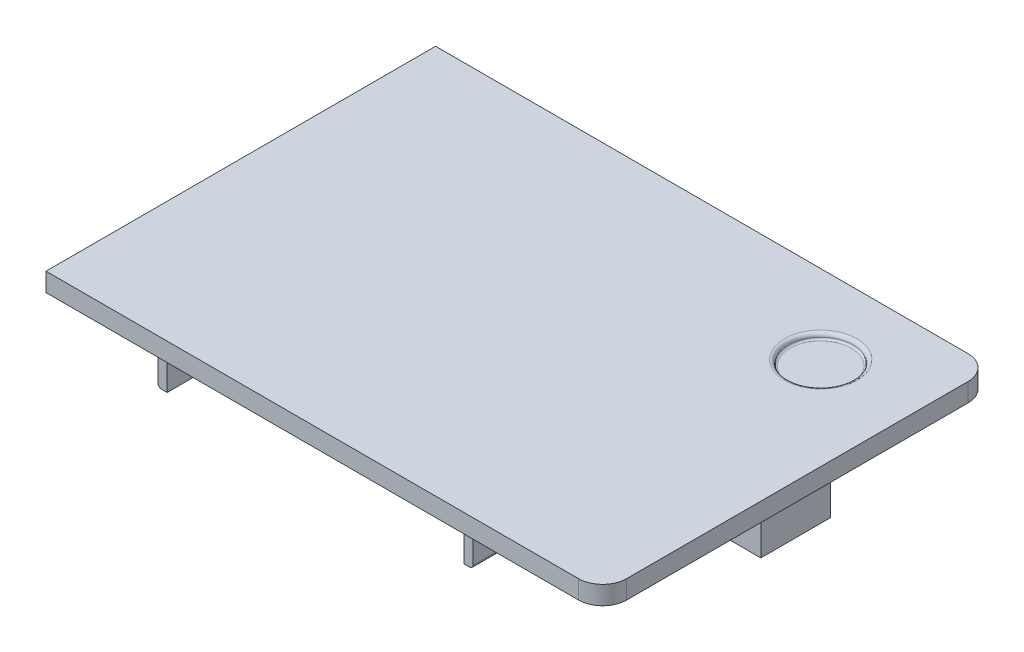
SolidWorks part; units mm, degrees
ref_plane "Front Plane" through (0, 0, 0) normal (0, 0, 1) x (1, 0, 0)
ref_plane "Top Plane" through (0, 0, 0) normal (0, 1, 0) x (1, 0, 0)
ref_plane "Right Plane" through (0, 0, 0) normal (1, 0, 0) x (0, 0, -1)
sketch "Sketch1" plane through (0, 0, 0) normal (0, 1, 0) x (1, 0, 0)
  line L1 (-381, -266.7) -> (381, -266.7)
  line L2 (-381, -266.7) -> (-381, 266.7)
  line L3 (-381, 266.7) -> (381, 266.7)
  line L4 (381, -266.7) -> (381, 266.7)
  line L5 (-381, -266.7) -> (381, 266.7) construction
  line L6 (-381, 266.7) -> (381, -266.7) construction
  point P0 (0, 0)
  dimension "D1" = 762
  dimension "D2" = 533.4
extrude "Boss-Extrude1" add sketch "Sketch1" along normal blind 25.4
fillet "Fillet1" radius 33.02 2 edges at (381, 12.7, -266.7) (381, 12.7, 266.7)
sketch "Sketch2" plane through (0, 0, 0) normal (0, -1, 0) x (1, 0, 0)
  line L0 (-217.7072, 266.7) -> (-217.7072, 114.3)
  line L1 (-381, 266.7) -> (347.98, 266.7) construction
  line L2 (-217.7072, 114.3) -> (188.6928, 114.3)
  line L3 (188.6928, 114.3) -> (188.6928, 266.7)
  line L4 (-230.4072, 266.7) -> (-230.4072, 101.6)
  line L5 (-230.4072, 101.6) -> (201.3928, 101.6)
  line L6 (201.3928, 101.6) -> (201.3928, 266.7)
  line L7 (-230.4072, 266.7) -> (-217.7072, 266.7)
  line L8 (188.6928, 266.7) -> (201.3928, 266.7)
  dimension "D1" = 406.4
  dimension "D2" = 152.4
  dimension "D3" = 12.7
extrude "Boss-Extrude2" add sketch "Sketch2" along normal blind 38.1
sketch "Sketch3" plane through (0, 25.4, 0) normal (0, 1, 0) x (1, 0, 0)
  line L0 (381, -233.68) -> (381, 233.68) construction
  circle A0 centre (254, 158.889) radius 44.45
  dimension "D1" = 127
extrude "Cut-Extrude1" cut sketch "Sketch3" against normal blind 7.62
fillet "Fillet2" radius 2.54 1 edges at (254, 17.78, -114.439)
fillet "Fillet3" radius 5.08 1 edges at (254, 25.4, -114.439)
fillet "Fillet4" radius 5.08 5 edges at (-14.5072, -38.1, 101.6) (-230.4072, -38.1, 184.15) (201.3928, -38.1, 184.15) (-230.4072, -19.05, 101.6) (201.3928, -19.05, 101.6)
sketch "Sketch4" plane through (0, 0, 0) normal (0, -1, 0) x (1, 0, 0)
  line L0 (381, 233.68) -> (381, -233.68) construction
  line L1 (381, 47.5173) -> (-342.9, 47.5173)
  line L2 (381, 47.5173) -> (381, -47.7327)
  line L3 (381, -47.7327) -> (-342.9, -47.7327)
  line L4 (-342.9, 47.5173) -> (-342.9, -47.7327)
  arc A1 (347.98, -266.7) -> (381, -233.68) centre (347.98, -233.68) ccw construction
  point P9 (371.3287, -257.0287)
  dimension "D3" = 209.296
  dimension "D1" = 723.9
  dimension "D2" = 95.25
extrude "Boss-Extrude3" add sketch "Sketch4" along normal blind 44.45
sketch "Sketch6" plane through (0, -44.45, 0) normal (0, -1, 0) x (1, 0, 0)
  line L0 (334.4392, 34.8173) -> (334.4392, -32.9044)
  line L1 (381, -47.7327) -> (381, 47.5173) construction
  line L2 (381, 47.5173) -> (-342.9, 47.5173) construction
  arc A0 (334.4392, -32.9044) -> (334.4392, 34.8173) centre (334.4392, 0.9565) ccw
  point P5 (368.3, 0.9565)
  dimension "D4" = 33.8608
  dimension "D1" = 12.7
  dimension "D2" = 12.7
  dimension "D3" = 0
extrude "Cut-Extrude2" cut sketch "Sketch6" against normal blind 24.384
fillet "Fillet5" radius 5.08 3 edges at (334.4392, -20.066, 0.9565) (368.3, -20.066, 0.9565) (368.3, -44.45, 0.9565)
fillet "Fillet6" radius 2.54 1 edges at (334.4392, -44.45, 0.9565)
sketch "Sketch7" plane through (0, 0, 266.7) normal (0, 0, 1) x (1, 0, 0)
  line L0 (188.6928, 0) -> (201.3928, 0)
  line L1 (-217.7072, 0) -> (-230.4072, 0)
  line L2 (188.6928, 0) -> (188.6928, -38.1)
  line L3 (188.6928, -38.1) -> (196.3128, -38.1)
  line L4 (201.3928, -33.02) -> (201.3928, 0)
  line L5 (-230.4072, 0) -> (-230.4072, -33.02)
  line L6 (-225.3272, -38.1) -> (-217.7072, -38.1)
  line L7 (-217.7072, -38.1) -> (-217.7072, 0)
  arc A0 (196.3128, -38.1) -> (201.3928, -33.02) centre (196.3128, -33.02) ccw
  arc A1 (-230.4072, -33.02) -> (-225.3272, -38.1) centre (-225.3272, -33.02) ccw
extrude "Cut-Extrude3" cut sketch "Sketch7" against normal blind 2.54
sketch "Sketch8" plane through (381, 0, 0) normal (1, 0, 0) x (0, 0, -1)
  line L0 (-47.5173, 0) -> (47.7327, 0)
  line L1 (47.7327, 0) -> (47.7327, -44.45)
  line L2 (47.7327, -44.45) -> (-47.5173, -44.45)
  line L3 (-47.5173, -44.45) -> (-47.5173, 0)
extrude "Cut-Extrude4" cut sketch "Sketch8" against normal blind 2.54
